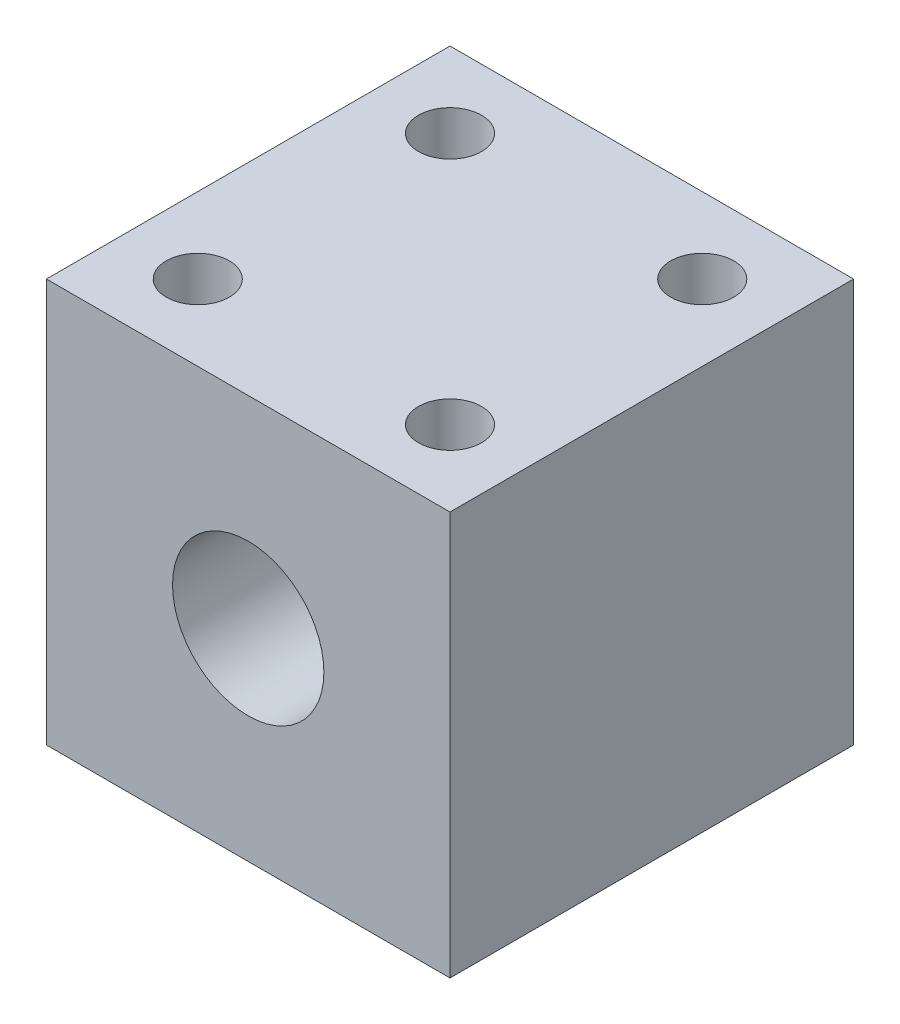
SolidWorks part; units mm, degrees
ref_plane "前视基准面" through (0, 0, 0) normal (0, 0, 1) x (1, 0, 0)
ref_plane "上视基准面" through (0, 0, 0) normal (0, 1, 0) x (1, 0, 0)
ref_plane "右视基准面" through (0, 0, 0) normal (1, 0, 0) x (0, 0, -1)
sketch "草图1" plane through (0, 0, 0) normal (0, 0, 1) x (1, 0, 0)
  line L1 (-8, -8) -> (8, -8)
  line L2 (-8, -8) -> (-8, 8)
  line L3 (-8, 8) -> (8, 8)
  line L4 (8, -8) -> (8, 8)
  line L5 (-8, -8) -> (8, 8) construction
  line L6 (-8, 8) -> (8, -8) construction
  point P0 (0, 0)
  dimension "D1" = 16
  dimension "D2" = 16
extrude "凸台-拉伸1" add sketch "草图1" along normal blind 16
sketch "草图2" plane through (0, 0, 16) normal (0, 0, 1) x (1, 0, 0)
  circle A0 centre (0, 0) radius 3
  dimension "D1" = 6
extrude "切除-拉伸1" cut sketch "草图2" against normal blind 16
hole_wizard "M3 螺纹孔1" positions "草图3" profile "草图4" tap size "M3" standard "GB"
sketch "草图3" plane through (0, 8, 0) normal (0, 1, 0) x (1, 0, 0)
  line L0 (-8, -8) -> (8, -8) construction
  line L1 (-8, -16) -> (-8, 0) construction
  line L2 (8, -16) -> (8, 0) construction
  line L4 (0, 0) -> (0, -16) construction
  line L5 (8, -16) -> (-8, -16) construction
  point P15 (-5, -3)
  point P19 (5, -3)
  point P20 (5, -13)
  point P21 (-5, -13)
  dimension "D1" = 10
  dimension "D2" = 10
sketch "草图4" plane through (-5, 8, 13) normal (1, 0, 0) x (0, 0, 1)
  line L0 (0, 0) -> (0, 16)
  line L1 (0, 16) -> (1.25, 16)
  line L2 (1.25, 16) -> (1.25, 0)
  line L5 (1.25, 0) -> (0, 0)
  line L11 (0, -6.35) -> (0, 107.95) construction
  dimension "通孔螺纹孔钻头直径" = 2.5
  dimension "通孔螺纹孔钻头深度" = 16
